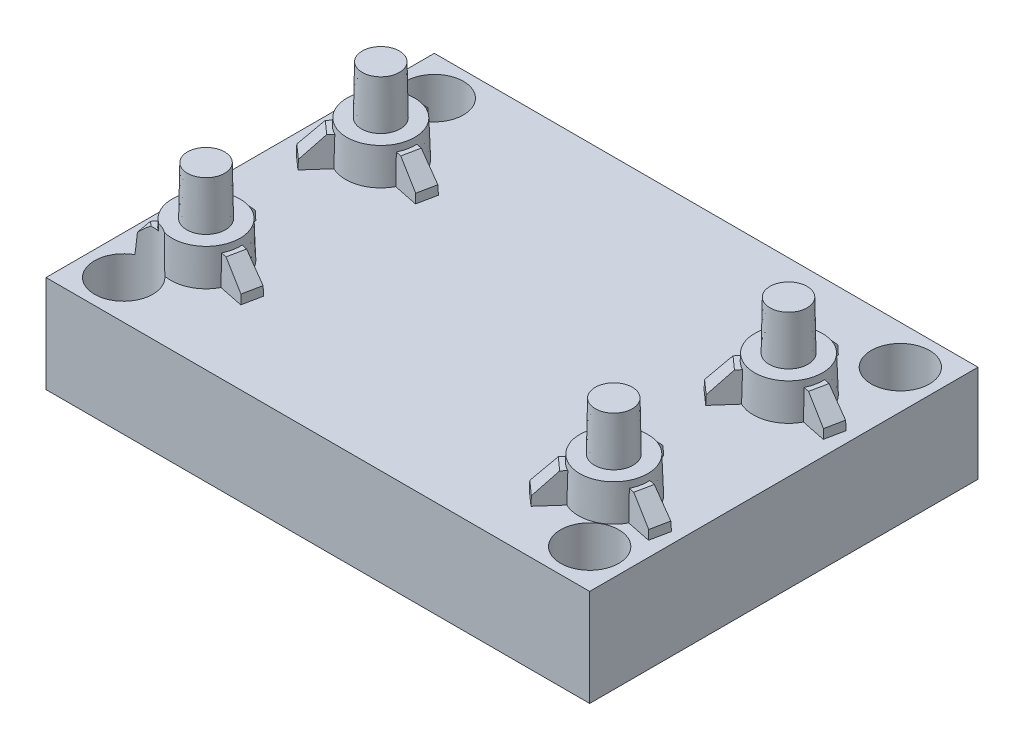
SolidWorks part; units mm, degrees
ref_plane "Front Plane" through (0, 0, 0) normal (0, 0, 1) x (1, 0, 0)
ref_plane "Top Plane" through (0, 0, 0) normal (0, 1, 0) x (1, 0, 0)
ref_plane "Right Plane" through (0, 0, 0) normal (1, 0, 0) x (0, 0, -1)
sketch "Sketch1" plane through (0, 0, 0) normal (0, 1, 0) x (1, 0, 0)
  line L1 (14, -10) -> (-14, -10)
  line L2 (14, -10) -> (14, 10)
  line L3 (14, 10) -> (-14, 10)
  line L4 (-14, -10) -> (-14, 10)
  line L5 (14, -10) -> (-14, 10) construction
  line L6 (14, 10) -> (-14, -10) construction
  point P0 (0, 0)
  dimension "D1" = 28
  dimension "D2" = 20
extrude "Boss-Extrude1" add sketch "Sketch1" along normal blind 5
sketch "Sketch2" plane through (0, 5, 0) normal (0, 1, 0) x (1, 0, 0)
  circle A0 centre (-10.6549, 3.8984) radius 1.5
  circle A1 centre (10.3451, 3.8984) radius 1.5
  circle A2 centre (10.3451, -5.1016) radius 1.5
  circle A3 centre (-10.6549, -5.1016) radius 1.5
sketch3d "3DSketch1"
  circle A0 centre (10.3451, 5, 5.1016) radius 1.5 construction
  point P0 (10.3451, 5, 5.1016)
  point P3 (10.3451, 6.5, 5.1016)
other "Mounting Boss1" parameters "BossHeight"=2, "BossDiam"=3.5, "D3"=0, "D4"=0, "D5"=0, "D6"=0, "D7"=0, "D8"=0, "InsDiam"=2, "InsHeight"=2.5, "Clearance"=0.15, "FinLength"=3, "FinWidth"=1, "FinHeight"=1.5, "ChamferDist"=1, "BossDraft"=2, "D17"=0, "D18"=0, "InsDraft"=1, "FinDraft"=2, "ChamferAngle"=45
pattern_linear "LPattern1" count 2 spacing 9 of "Mounting Boss1"
pattern_linear "LPattern2" count 2 spacing 21 along (-1, 0, 0) of "LPattern1", "Mounting Boss1"
sketch "Sketch3" plane through (0, 5, 0) normal (0, 1, 0) x (1, 0, 0)
  line L0 (14, 10) -> (-14, 10) construction
  line L1 (-14, 10) -> (-14, -10) construction
  line L2 (0, 0) -> (0, 1.3106) construction
  line L3 (0, 1.3106) -> (0, 0) construction
  line L4 (0, 0) -> (2.7574, 0) construction
  circle A0 centre (-12, 8) radius 1.5
  circle A1 centre (12, 8) radius 1.5
  circle A2 centre (12, -8) radius 1.5
  circle A3 centre (-12, -8) radius 1.5
  dimension "D1" = 2
  dimension "D3" = 3
  dimension "D2" = 2
extrude "Cut-Extrude1" cut sketch "Sketch3" against normal through all both and the other way through all
